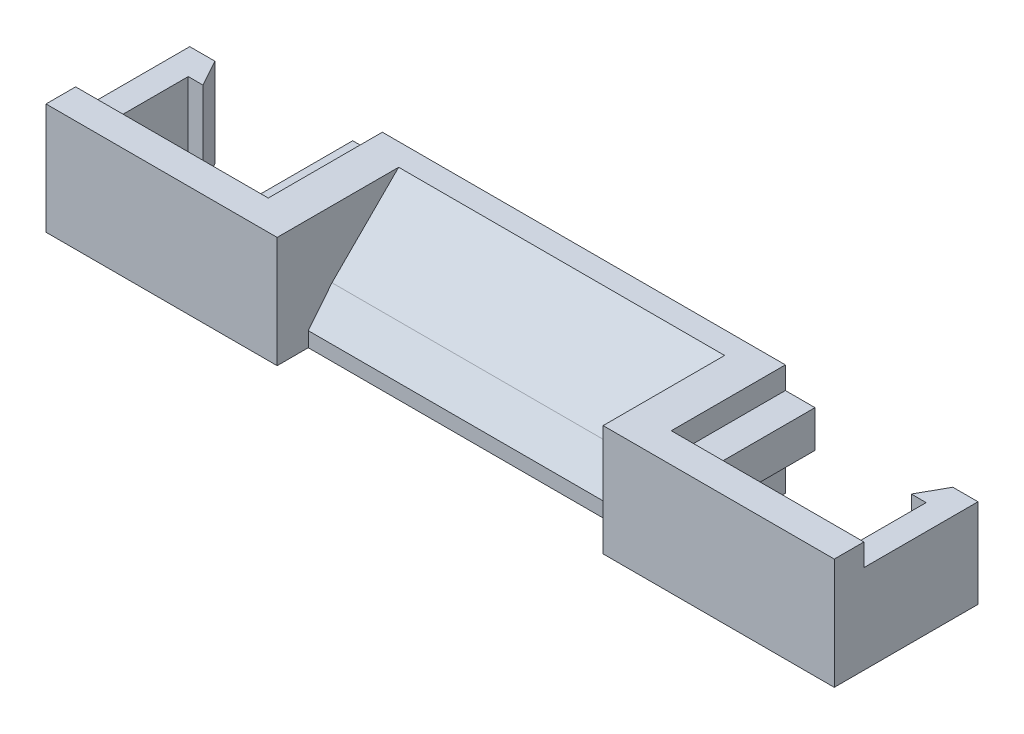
SolidWorks part; units mm, degrees
ref_plane "Alzado" through (0, 0, 0) normal (0, 0, 1) x (1, 0, 0)
ref_plane "Planta" through (0, 0, 0) normal (0, 1, 0) x (1, 0, 0)
ref_plane "Vista lateral" through (0, 0, 0) normal (1, 0, 0) x (0, 0, -1)
sketch "Croquis1" plane through (0, 0, 0) normal (0, 0, 1) x (1, 0, 0)
  line L0 (0, 0) -> (27.2, 0)
  line L1 (0, 0) -> (0, 7.5)
  line L2 (0, 7.5) -> (27.2, 7.5)
  line L3 (27.2, 7.5) -> (27.2, 0)
extrude "Saliente-Extruir1" add sketch "Croquis1" along normal blind 9.7
sketch "Croquis2" plane through (0, 0, 9.7) normal (0, 0, 1) x (1, 0, 0)
  line L0 (0, 3.75) -> (2.6, 3.75) construction
  line L1 (0, 7.5) -> (0, 0) construction
ref_plane "Plano1" through (2.6, 0, 0) normal (1, 0, 0) x (0, 0, -1)
sketch "Croquis3" plane through (2.6, 0, 0) normal (1, 0, 0) x (0, 0, -1)
  line L0 (0, 0.7195) -> (-7.6, 0.7195) construction
  line L1 (0, 0) -> (0, 7.5) construction
  line L2 (-7.6, 0) -> (-7.6, 1)
  line L3 (-9.7, 0) -> (0, 0) construction
  line L4 (0, 3) -> (-6, 3) construction
  line L5 (-4.7433, 3) -> (-4.7433, 0) construction
  line L6 (-7.6, 1) -> (-6, 3)
  line L7 (-1.5, 7.5) -> (-1.5, 7.0651) construction
  line L8 (-9.7, 7.5) -> (0, 7.5) construction
  line L9 (0, 7.2074) -> (-1.5, 7.2074) construction
  line L10 (-6, 3) -> (-1.5, 7.5)
  line L11 (-1.5, 7.5) -> (-1.5, 8.6775)
  line L12 (-1.5, 8.6775) -> (-10.7937, 8.6775)
  line L13 (-10.7937, 8.6775) -> (-10.7937, -0.8017)
  line L14 (-10.7937, -0.8017) -> (-7.6, -0.8017)
  line L15 (-7.6, -0.8017) -> (-7.6, 0)
extrude "Cortar-Extruir1" cut sketch "Croquis3" along normal blind 22
sketch "Croquis4" plane through (0, 0, 9.7) normal (0, 0, 1) x (1, 0, 0)
  line L0 (2.6, 3.75) -> (24.6, 3.75) construction
  line L1 (24.6, 3) -> (24.6, 7.5) construction
  line L2 (24.6, 3.75) -> (27.2, 3.75) construction
  line L3 (27.2, 0) -> (27.2, 7.5) construction
sketch "Croquis6" plane through (27.2, 0, 0) normal (1, 0, 0) x (0, 0, -1)
  line L0 (-4.85, 0) -> (-4.85, 3.5) construction
  line L1 (-9.7, 0) -> (0, 0) construction
  line L2 (-9.7, 3.5) -> (0, 3.5)
  line L3 (-9.7, 0) -> (-9.7, 7.5) construction
  line L4 (0, 0) -> (0, 7.5) construction
  line L5 (-4.85, 3.5) -> (-4.85, 6) construction
  line L6 (-9.7, 6) -> (0, 6)
  line L7 (0, 6) -> (0, 3.5)
  line L8 (-9.7, 6) -> (-9.7, 3.5)
extrude "Saliente-Extruir2" add sketch "Croquis6" along normal blind 2
sketch "Croquis7" plane through (0, 0, 0) normal (-1, 0, 0) x (0, 0, 1)
  line L0 (9.7, 3.5) -> (0, 3.5) construction
  line L1 (0, 6) -> (9.7, 6) construction
  line L2 (9.7, 3.5) -> (0, 3.5)
  line L3 (0, 6) -> (9.7, 6)
  line L4 (9.7, 6) -> (9.7, 3.5) construction
  line L5 (0, 3.5) -> (0, 6) construction
  line L6 (9.7, 6) -> (9.7, 3.5)
  line L7 (0, 3.5) -> (0, 6)
extrude "Saliente-Extruir3" add sketch "Croquis7" along normal blind 2
sketch "Croquis8" plane through (27.2, 0, 0) normal (1, 0, 0) x (0, 0, -1)
  line L1 (-7.7, 7.5) -> (-9.7, 7.5)
  line L2 (-7.7, 7.5) -> (-7.7, 0)
  line L3 (-7.7, 0) -> (-9.7, 0)
  line L4 (-9.7, 7.5) -> (-9.7, 0)
extrude "Saliente-Extruir4" add sketch "Croquis8" along normal blind 13
sketch "Croquis9" plane through (0, 0, 0) normal (-1, 0, 0) x (0, 0, 1)
  line L4 (9.7, 0) -> (7.7, 0)
  line L5 (7.7, 7.5) -> (9.7, 7.5)
  line L6 (9.7, 7.5) -> (9.7, 0)
  line L7 (7.7, 0) -> (7.7, 7.5)
extrude "Saliente-Extruir5" add sketch "Croquis9" along normal blind 13
sketch "Croquis11" plane through (0, 0, 7.7) normal (0, 0, -1) x (-1, 0, 0)
  line L1 (-40.2, 6) -> (-38.5, 6)
  line L2 (-40.2, 6) -> (-40.2, 0)
  line L3 (-40.2, 0) -> (-38.5, 0)
  line L4 (-38.5, 6) -> (-38.5, 0)
  line L5 (11.3, 6) -> (13, 6)
  line L6 (11.3, 6) -> (11.3, 0)
  line L7 (11.3, 0) -> (13, 0)
  line L8 (13, 6) -> (13, 0)
extrude "Saliente-Extruir7" add sketch "Croquis11" along normal up to surface (7.7 mm away)
sketch "Croquis12" plane through (0, 6, 0) normal (0, 1, 0) x (1, 0, 0)
  line L0 (38.5, 0) -> (38.5, -1.8)
  line L1 (40.2, -1.8) -> (37.5, -1.8) construction
  line L2 (40.2, 0) -> (40.2, -7.7) construction
  line L3 (38.5, -1.8) -> (37.5, -1.8)
  line L4 (37.5, -1.8) -> (38.5, 0)
  line L5 (13.6, 0) -> (13.6, -12.5762) construction
  line L6 (27.2, 0) -> (0, 0) construction
  line L7 (-10.3, -1.8) -> (-11.3, 0)
  line L8 (-11.3, -1.8) -> (-10.3, -1.8)
  line L9 (-11.3, 0) -> (-11.3, -1.8)
extrude "Saliente-Extruir8" add sketch "Croquis12" against normal up to surface (6 mm away)
